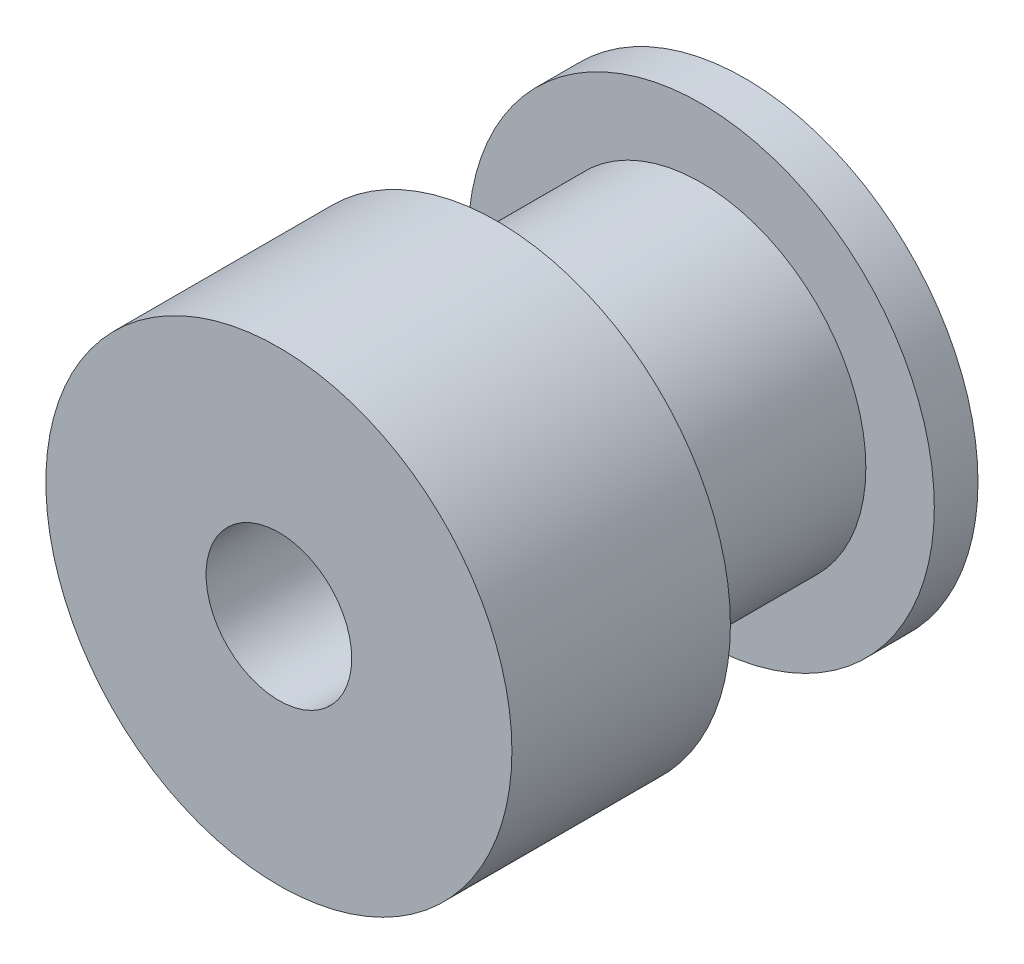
SolidWorks part; units mm, degrees
ref_plane "Alzado" through (0, 0, 0) normal (0, 0, 1) x (1, 0, 0)
ref_plane "Planta" through (0, 0, 0) normal (0, 1, 0) x (1, 0, 0)
ref_plane "Vista lateral" through (0, 0, 0) normal (1, 0, 0) x (0, 0, -1)
sketch "Croquis1" plane through (0, 0, 0) normal (0, 0, 1) x (1, 0, 0)
  circle A0 centre (0, 0) radius 2.5
  circle A1 centre (0, 0) radius 8
  dimension "D1" = 16
  dimension "D2" = 5
extrude "Saliente-Extruir1" add sketch "Croquis1" along normal blind 1.5
sketch "Croquis2" plane through (0, 0, 1.5) normal (0, 0, 1) x (1, 0, 0)
  circle A0 centre (0, 0) radius 5.65
  circle A1 centre (0, 0) radius 2.5 construction
  circle A2 centre (0, 0) radius 2.5
  dimension "D1" = 11.3
extrude "Saliente-Extruir2" add sketch "Croquis2" along normal blind 7
sketch "Croquis3" plane through (0, 0, 8.5) normal (0, 0, 1) x (1, 0, 0)
  circle A0 centre (0, 0) radius 2.5 construction
  circle A1 centre (0, 0) radius 2.5
  circle A2 centre (0, 0) radius 8 construction
  circle A3 centre (0, 0) radius 8
extrude "Saliente-Extruir3" add sketch "Croquis3" along normal blind 7.5
